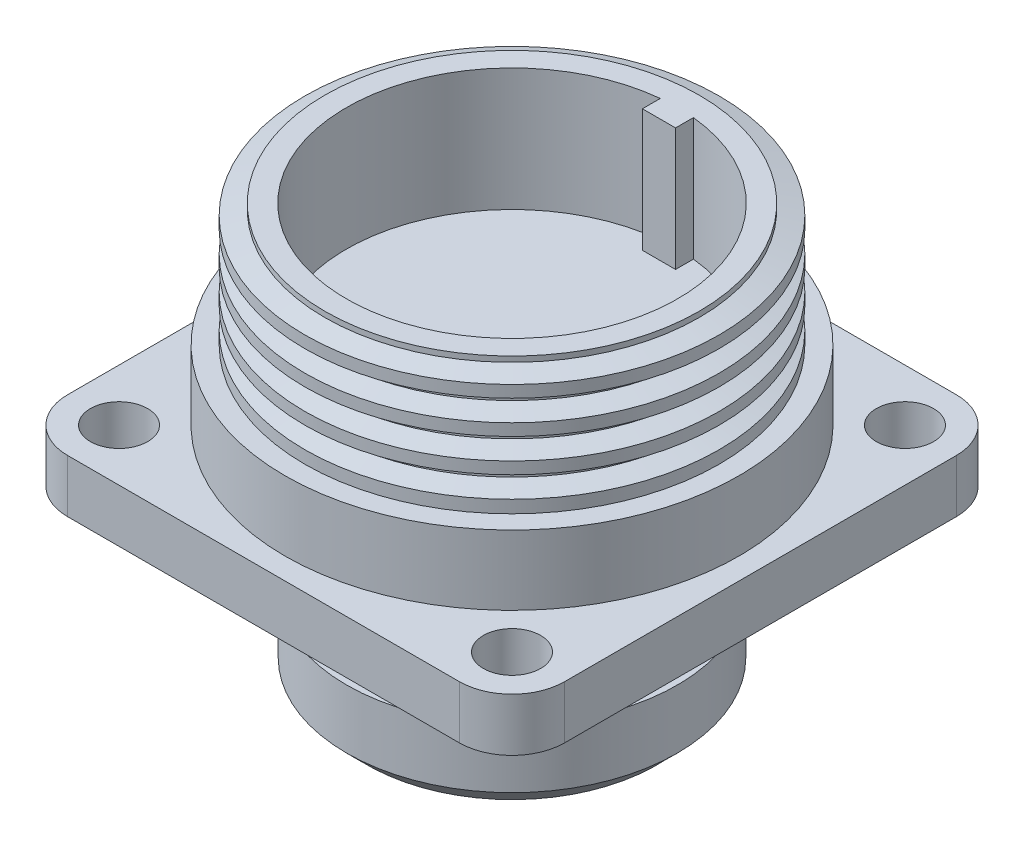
SolidWorks part; units mm, degrees
ref_plane "Front" through (0, 0, 0) normal (0, 0, 1) x (1, 0, 0)
ref_plane "Top" through (0, 0, 0) normal (0, 1, 0) x (1, 0, 0)
ref_plane "Right" through (0, 0, 0) normal (1, 0, 0) x (0, 0, -1)
sketch "Sketch1" plane through (0, 0, 0) normal (0, 1, 0) x (1, 0, 0)
  line L0 (-19.05, 19.05) -> (19.05, -19.05) construction
  line L1 (-19.05, 19.05) -> (19.05, 19.05)
  line L2 (-19.05, 19.05) -> (-19.05, -19.05)
  line L3 (-19.05, -19.05) -> (19.05, -19.05)
  line L4 (19.05, 19.05) -> (19.05, -19.05)
  line L5 (0, 0) -> (0, 12.3288) construction
  line L6 (0, 0) -> (-11.4601, 0) construction
  circle A0 centre (-15.0622, 15.0622) radius 2.1971
  circle A1 centre (15.0622, 15.0622) radius 2.1971
  circle A2 centre (15.0622, -15.0622) radius 2.1971
  circle A3 centre (-15.0622, -15.0622) radius 2.1971
  dimension "D4" = 4.3942
  dimension "D1" = 38.1
  dimension "D2" = 38.1
  dimension "D3" = 15.0622
extrude "Base-Extrude" add sketch "Sketch1" along normal blind 4.064
sketch "Sketch2" plane through (0, 4.064, 0) normal (0, 1, 0) x (-1, 0, 0)
  circle A0 centre (0, 0) radius 17.399
  dimension "D1" = 34.798
extrude "Boss-Extrude1" add sketch "Sketch2" along normal blind 5.334
sketch "Sketch9" plane through (0, 9.398, 0) normal (0, 1, 0) x (1, 0, 0)
  circle A0 centre (0, 0) radius 15.875
  dimension "D1" = 31.75
extrude "Extrude1" add sketch "Sketch9" along normal blind 9.398
sketch "Sketch3" plane through (0, 0, 0) normal (0, -1, 0) x (1, 0, 0)
  circle A0 centre (0, 0) radius 12.6746
  dimension "D1" = 25.3492
extrude "Plug" add sketch "Sketch3" along normal blind 12.954
chamfer "Chamfer1" distance 1.5748 angle 45 1 edges at (0, -12.954, -12.6746)
sketch "Sketch10" plane through (0, 18.796, 0) normal (0, 1, 0) x (1, 0, 0)
  line L0 (0, 15.2021) -> (0, 11.2679) construction
  line L1 (-1.27, 15.2021) -> (1.27, 15.2021) construction
  line L2 (-1.27, 12.6363) -> (-1.27, 11.2679)
  line L3 (-1.27, 11.2679) -> (1.27, 11.2679)
  line L4 (1.27, 12.6363) -> (1.27, 11.2679)
  line L5 (1.27, 12.6363) -> (1.27, 15.2021) construction
  line L6 (-1.27, 12.6363) -> (-1.27, 15.2021) construction
  arc A0 (-1.27, 12.6363) -> (1.27, 12.6363) centre (0, 0) ccw
  dimension "D1" = 25.4
  dimension "D2" = 2.54
extrude "Cut-Extrude1" cut sketch "Sketch10" against normal up to surface (9.398 mm away)
fillet "Fillet1" radius 4.0386 4 edges at (-19.05, 2.032, -19.05) (19.05, 2.032, -19.05) (19.05, 2.032, 19.05) (-19.05, 2.032, 19.05)
ref_plane "Plane1" through (0, -12.954, 0) normal (0, 0, 1) x (1, 0, 0)
sketch "Sketch7" plane through (0, 0, 0) normal (1, 0, 0) x (0, 0, -1)
  line L0 (12.6746, -11.3792) -> (12.6746, 0) construction
  line L1 (12.6746, -4.4958) -> (11.43, -4.4958)
  line L2 (12.6746, -4.4958) -> (12.6746, -6.858)
  line L3 (12.6746, -6.858) -> (11.43, -6.858)
  line L4 (11.43, -4.4958) -> (11.43, -6.858)
  line L5 (0, 0) -> (0, -8.0047) construction
  line L6 (-11.43, -4.4958) -> (-11.43, -6.858) construction
  line L7 (-15.0114, 0) -> (15.0114, 0) construction
  dimension "D1" = 22.86
  dimension "D2" = 2.3622
  dimension "D3" = 6.858
revolve "#2-020" cut sketch "Sketch7" angle 360 about L5
sketch "Sketch8" plane through (0, 0, 0) normal (1, 0, 0) x (0, 0, -1)
  line L0 (-15.0114, 0) -> (15.0114, 0) construction
  line L1 (13.3477, 0) -> (15.9131, 0)
  line L2 (13.3477, 0) -> (13.3477, 1.27)
  line L3 (13.3477, 1.27) -> (15.9131, 1.27)
  line L4 (15.9131, 0) -> (15.9131, 1.27)
  line L5 (0, 0) -> (0, 8.4715) construction
  line L6 (-13.3477, 0) -> (-13.3477, 1.27) construction
  dimension "D1" = 26.6954
  dimension "D2" = 2.5654
  dimension "D3" = 1.27
revolve "#2-023Cut-Revolve3" cut sketch "Sketch8" angle 360 about L5
sketch "Sketch11" plane through (0, 0, 0) normal (0, 0, 1) x (1, 0, 0)
  line L0 (14.351, 19.2151) -> (14.351, 18.3769)
  line L1 (14.351, 18.3769) -> (15.875, 17.9828)
  line L2 (15.875, 9.398) -> (15.875, 18.796) construction
  line L3 (15.875, 17.9828) -> (15.875, 17.0692)
  line L4 (0, 0) -> (0, 12.2919) construction
  line L5 (18.683, 9.4484) -> (15.875, 9.4484)
  line L6 (18.683, 9.4484) -> (18.683, 19.6092)
  line L7 (18.683, 19.6092) -> (15.875, 19.6092)
  line L8 (14.351, 19.2151) -> (15.875, 19.6092)
  line L9 (15.875, 18.796) -> (-15.875, 18.796) construction
  line L41 (14.351, 16.6751) -> (15.875, 17.0692)
  line L42 (14.351, 16.6751) -> (14.351, 15.8369)
  line L43 (14.351, 15.8369) -> (15.875, 15.4428)
  line L44 (15.875, 15.4428) -> (15.875, 14.5292)
  line L49 (14.351, 14.1351) -> (15.875, 14.5292)
  line L50 (14.351, 14.1351) -> (14.351, 13.2969)
  line L51 (14.351, 13.2969) -> (15.875, 12.9028)
  line L52 (15.875, 12.9028) -> (15.875, 11.9892)
  line L57 (14.351, 11.5951) -> (15.875, 11.9892)
  line L58 (14.351, 11.5951) -> (14.351, 10.7569)
  line L59 (14.351, 10.7569) -> (15.875, 10.3628)
  line L60 (15.875, 10.3628) -> (15.875, 9.4484)
  point P0 (14.351, 18.796)
  dimension "D1" = 0.8382
  dimension "D3" = 1.524
  dimension "D4" = 29
revolve "Cut-Revolve1" cut sketch "Sketch11" angle 360 about L4
